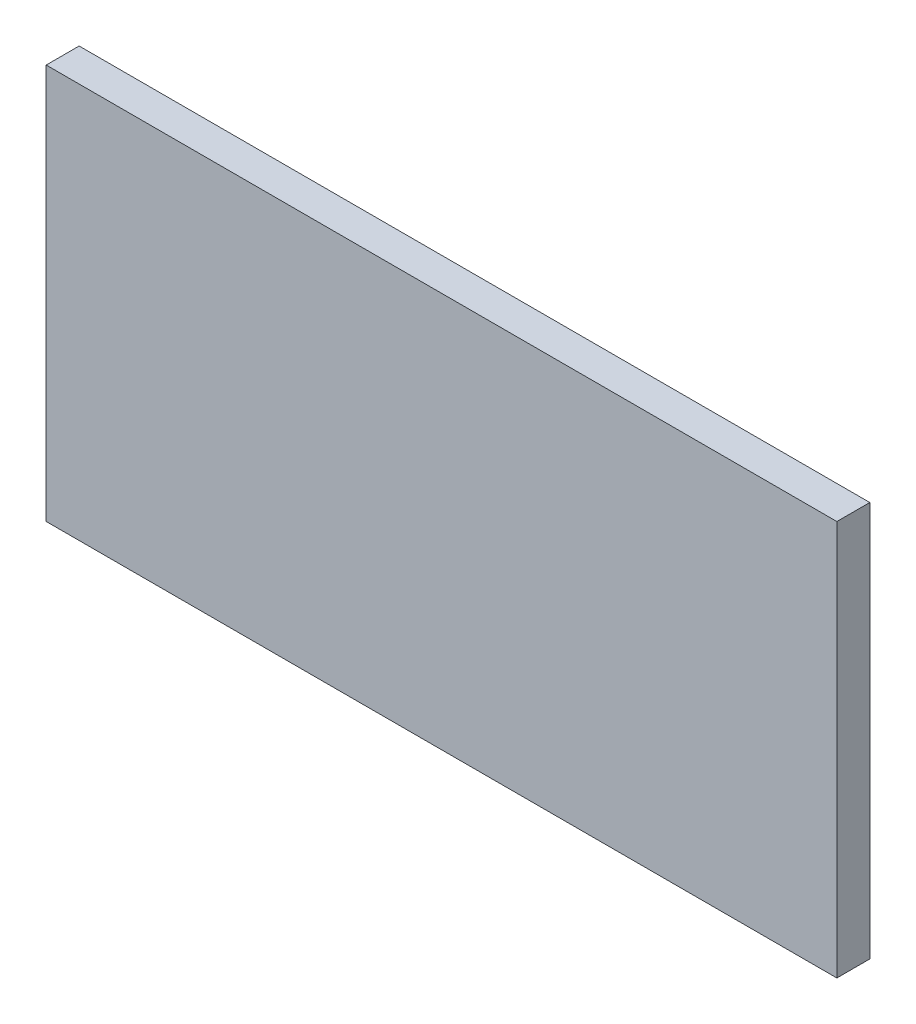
SolidWorks part; units mm, degrees
ref_plane "Face" through (0, 0, 0) normal (0, 0, 1) x (1, 0, 0)
ref_plane "Dessus" through (0, 0, 0) normal (0, 1, 0) x (1, 0, 0)
ref_plane "Droite" through (0, 0, 0) normal (1, 0, 0) x (0, 0, -1)
sketch "Esquisse1" plane through (0, 0, 0) normal (0, 0, 1) x (1, 0, 0)
  line L1 (0, 0) -> (120, 0)
  line L2 (0, 0) -> (0, -60)
  line L3 (0, -60) -> (120, -60)
  line L4 (120, 0) -> (120, -60)
  dimension "D1" = 120
  dimension "D2" = 60
extrude "Base-Extrusion" add sketch "Esquisse1" along normal blind 5
